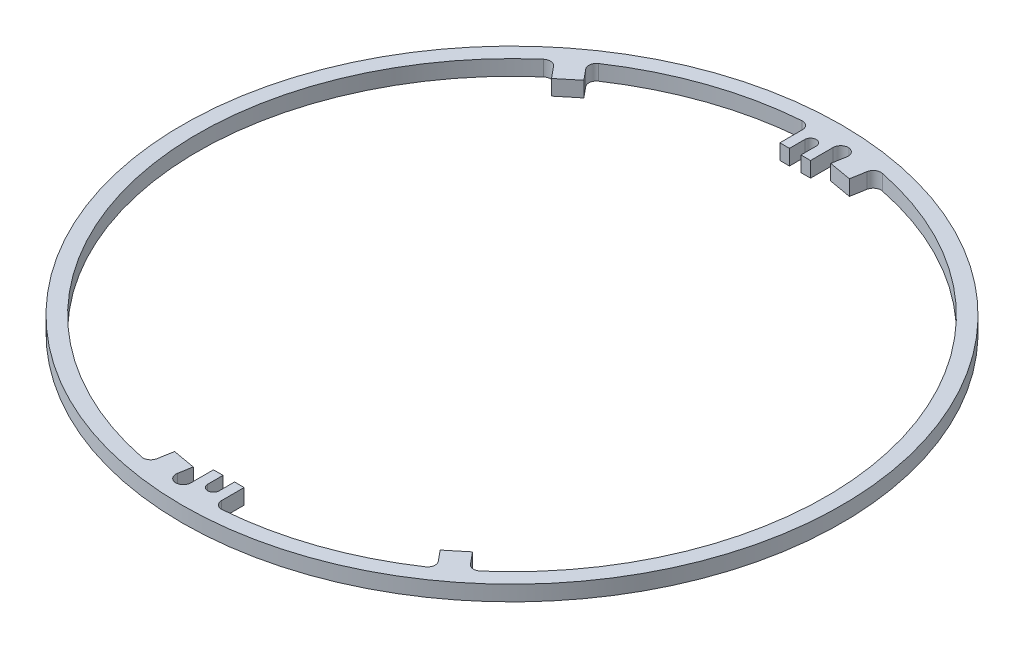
SolidWorks part; units mm, degrees
ref_plane "前视基准面" through (0, 0, 0) normal (0, 0, 1) x (1, 0, 0)
ref_plane "上视基准面" through (0, 0, 0) normal (0, 1, 0) x (1, 0, 0)
ref_plane "右视基准面" through (0, 0, 0) normal (1, 0, 0) x (0, 0, -1)
sketch "草图1" plane through (0, 0, 0) normal (0, 1, 0) x (1, 0, 0)
  circle A0 centre (0, 0) radius 43
  circle A1 centre (0, 0) radius 41
  circle A2 centre (0, 0) radius 35 construction
  dimension "D1" = 86
  dimension "D2" = 2
  dimension "D3" = 70
extrude "凸台-拉伸1" add sketch "草图1" along normal blind 2
sketch "草图2" plane through (0, 2, 0) normal (0, 1, 0) x (1, 0, 0)
  line L0 (0, 0) -> (0, 47.3857) construction
  line L1 (-2, 40.9512) -> (-2, 36.9512)
  line L2 (-2, 36.9512) -> (2, 36.9512)
  line L3 (2, 40.9512) -> (2, 36.9512)
  line L4 (0, 0) -> (51.4644, 0) construction
  line L5 (2, -40.9512) -> (2, -36.9512)
  line L6 (-2, -40.9512) -> (-2, -36.9512)
  line L7 (-2, -36.9512) -> (2, -36.9512)
  circle A0 centre (0, 0) radius 41 construction
  circle A1 centre (0, 0) radius 41
  circle A3 centre (0, 38.9512) radius 0.75
  point P10 (0, 36.9512)
  dimension "D3" = 1.5
  dimension "D4" = 2
  dimension "D1" = 4
  dimension "D2" = 4
extrude "凸台-拉伸2" add sketch "草图2" against normal up to surface (2 mm away) contours L7 L6 L5 M8 | L3 L1 L2 M8
fillet "圆角1" radius 1 2 edges at (2, 1, -40.9512) (-2, 1, -40.9512)
fillet "圆角2" radius 1 2 edges at (2, 1, 40.9512) (-2, 1, 40.9512)
sketch "草图3" plane through (0, 2, 0) normal (0, 1, 0) x (1, 0, 0)
  line L0 (-0.75, 38.9512) -> (-0.75, 35.9512)
  line L1 (-0.75, 35.9512) -> (0.75, 35.9512)
  line L2 (0.75, 35.9512) -> (0.75, 38.9512)
  line L3 (0, 0) -> (58.5732, 0) construction
  line L4 (0.75, -35.9512) -> (0.75, -38.9512)
  line L5 (-0.75, -35.9512) -> (0.75, -35.9512)
  line L6 (-0.75, -38.9512) -> (-0.75, -35.9512)
  arc A0 (0.75, 38.9512) -> (-0.75, 38.9512) centre (0, 38.9512) ccw
  arc A1 (0.75, -38.9512) -> (-0.75, -38.9512) centre (0, -38.9512) cw
  dimension "D2" = 0.75
  dimension "D1" = 3
extrude "切除-拉伸1" cut sketch "草图3" against normal through all
sketch "草图4" plane through (0, 2, 0) normal (0, 1, 0) x (1, 0, 0)
  line L0 (0, 0) -> (-8.2972, -47.0555) construction
  line L1 (-7.1196, -40.3771) -> (-6.5986, -37.4227)
  line L2 (-6.5986, -37.4227) -> (-3.6442, -37.9436)
  line L3 (-3.6442, -37.9436) -> (-4.1461, -40.7898)
  line L4 (0, 0) -> (54.757, -9.6551) construction
  line L8 (0, 0) -> (0, -55.1104) construction
  line L9 (7.1196, 40.3771) -> (6.5986, 37.4227)
  line L10 (6.5986, 37.4227) -> (3.6442, 37.9436)
  line L11 (3.6442, 37.9436) -> (4.1461, 40.7898)
  arc A0 (-3.075, 40.8845) -> (-3.075, -40.8845) centre (0, 0) ccw construction
  arc A1 (-7.1196, -40.3771) -> (-4.1461, -40.7898) centre (0, 0) ccw
  arc A2 (7.1196, 40.3771) -> (4.1461, 40.7898) centre (0, 0) ccw
  point P19 (0, 0)
  dimension "D1" = 3
  dimension "D2" = 3
  dimension "D3" = 10
  dimension "D4" = 2
extrude "凸台-拉伸3" add sketch "草图4" against normal up to surface (2 mm away)
fillet "圆角4" radius 1 2 edges at (-4.1461, 1, 40.7898) (-7.1196, 1, 40.3771)
fillet "圆角6" radius 1 2 edges at (7.1196, 1, -40.3771) (4.1461, 1, -40.7898)
sketch "草图6" plane through (0, 0, 0) normal (0, -1, 0) x (1, 0, 0)
  line L0 (0, 0) -> (-7.6324, 43.2856) construction
  line L1 (0, 0) -> (32.4771, 39.3979) construction
  line L2 (26.0792, 31.6366) -> (24.171, 29.3217)
  line L3 (24.171, 29.3217) -> (21.8561, 31.23)
  line L4 (21.8561, 31.23) -> (23.6944, 33.46)
  line L5 (-26.0792, -31.6366) -> (-24.171, -29.3217)
  line L6 (-24.171, -29.3217) -> (-21.8561, -31.23)
  line L7 (-21.8561, -31.23) -> (-23.6944, -33.46)
  line L8 (-6.9438, 39.38) -> (-6.5986, 37.4227) construction
  arc A0 (8.1268, -40.1865) -> (3.075, 40.8845) centre (0, 0) ccw construction
  arc A1 (26.0792, 31.6366) -> (23.6944, 33.46) centre (0, 0) ccw
  arc A2 (-26.0792, -31.6366) -> (-23.6944, -33.46) centre (0, 0) ccw
  point P17 (0, 0)
  dimension "D1" = 49.5
  dimension "D2" = 3
  dimension "D3" = 3
  dimension "D4" = 2
extrude "凸台-拉伸4" add sketch "草图6" against normal up to surface (2 mm away)
fillet "圆角7" radius 1 4 edges at (-26.0792, 1, -31.6366) (-23.6944, 1, -33.46) (23.6944, 1, 33.46) (26.0792, 1, 31.6366)
